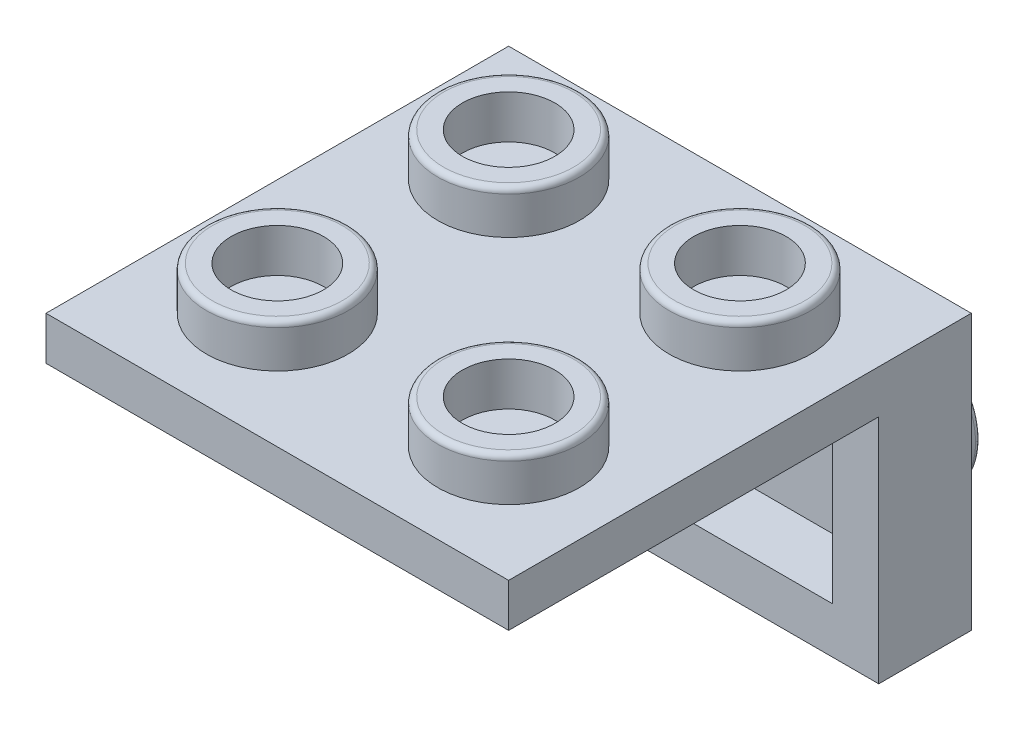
SolidWorks part; units mm, degrees
ref_plane "Vorne" through (0, 0, 0) normal (0, 0, 1) x (1, 0, 0)
ref_plane "Oben" through (0, 0, 0) normal (0, 1, 0) x (1, 0, 0)
ref_plane "Rechts" through (0, 0, 0) normal (1, 0, 0) x (0, 0, -1)
sketch "Skizze1" plane through (0, 0, 0) normal (0, 0, 1) x (1, 0, 0)
  line L1 (0, 0) -> (-16, 0)
  line L2 (0, 0) -> (0, -8)
  line L3 (0, -8) -> (-16, -8)
  line L4 (-16, 0) -> (-16, -8)
  dimension "D1" = 16
  dimension "D2" = 8
extrude "Linear austragen1" add sketch "Skizze1" along normal blind 3.2
sketch "Skizze2" plane through (0, 0, 3.2) normal (0, 0, 1) x (1, 0, 0)
  line L0 (-16, -8) -> (0, -8) construction
  line L1 (-1.6, -6.4) -> (-14.4, -6.4)
  line L2 (-1.6, -6.4) -> (-1.6, -1.6)
  line L3 (-1.6, -1.6) -> (-14.4, -1.6)
  line L4 (-14.4, -6.4) -> (-14.4, -1.6)
  line L5 (0, -8) -> (0, 0) construction
  dimension "D1" = 4.8
  dimension "D2" = 12.8
  dimension "D3" = 1.6
  dimension "D4" = 1.6
extrude "Schnitt-Linear austragen1" cut sketch "Skizze2" against normal blind 2.1
sketch "Skizze4" plane through (0, 0, 0) normal (0, 0, -1) x (-1, 0, 0)
  line L0 (0, 0) -> (16, 0) construction
  line L1 (0, -8) -> (0, 0) construction
  circle A0 centre (4, -4) radius 2.45
  dimension "D1" = 4.9
  dimension "D2" = 4
  dimension "D3" = 4
extrude "Linear austragen3" add sketch "Skizze4" along normal blind 1.9
fillet "Verrundung1" radius 0.2 1 edges at (-6.45, -4, -1.9)
pattern_linear "Lineares Muster1" count 2 spacing 8 along (-1, 0, 0) of "Verrundung1", "Linear austragen3"
sketch "Skizze5" plane through (0, 0, 1.1) normal (0, 0, 1) x (1, 0, 0)
  circle A0 centre (-7.9128, -3.8275) radius 1.5
  circle A1 centre (-7.9128, -3.8275) radius 0.7
  dimension "D1" = 1.4
  dimension "D2" = 3
extrude "Linear austragen4" add sketch "Skizze5" along normal blind 2
sketch "Skizze6" plane through (0, 0, 0) normal (0, 1, 0) x (-1, 0, 0)
  line L0 (16, 3.2) -> (16, 0) construction
  line L1 (16, 0) -> (0, 0)
  line L2 (16, 0) -> (16, 16)
  line L3 (16, 16) -> (0, 16)
  line L4 (0, 0) -> (0, 16)
  line L5 (0, 0) -> (16, 0) construction
  dimension "D1" = 16
  dimension "D2" = 16
extrude "Linear austragen5" add sketch "Skizze6" along normal blind 1.5
sketch "Skizze7" plane through (0, 1.5, 0) normal (0, 1, 0) x (-1, 0, 0)
  line L0 (0, 0) -> (16, 0) construction
  line L1 (16, 0) -> (16, 16) construction
  circle A0 centre (12, 4) radius 2.45
  circle A1 centre (12, 4) radius 1.6
  dimension "D1" = 4.9
  dimension "D2" = 3.2
  dimension "D3" = 4
  dimension "D4" = 4
extrude "Linear austragen6" add sketch "Skizze7" along normal blind 1.5
fillet "Verrundung4" radius 0.2 1 edges at (-14.45, 3, 4)
pattern_linear "Lineares Muster3" count 2 spacing 8 along (1, 0, 0) count 2 spacing 8 along (0, 0, 1) of "Verrundung4", "Linear austragen6"
